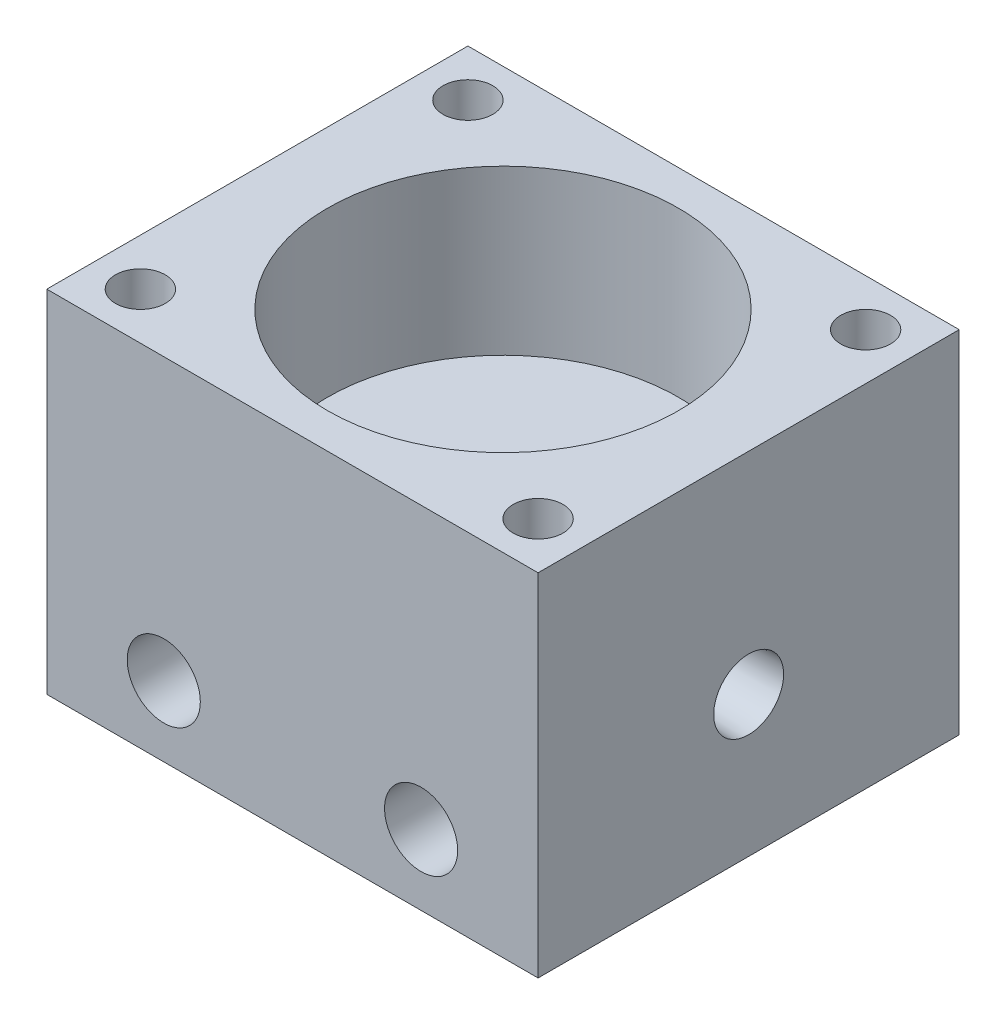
SolidWorks part; units mm, degrees
ref_plane "Front" through (0, 0, 0) normal (0, 0, 1) x (1, 0, 0)
ref_plane "Top" through (0, 0, 0) normal (0, 1, 0) x (1, 0, 0)
ref_plane "Right" through (0, 0, 0) normal (1, 0, 0) x (0, 0, -1)
sketch "Sketch2" plane through (0, 0, 0) normal (0, 1, 0) x (1, 0, 0)
  line L1 (-33.3375, 28.575) -> (33.3375, 28.575)
  line L2 (-33.3375, 28.575) -> (-33.3375, -28.575)
  line L3 (-33.3375, -28.575) -> (33.3375, -28.575)
  line L4 (33.3375, 28.575) -> (33.3375, -28.575)
  line L5 (-33.3375, 28.575) -> (33.3375, -28.575) construction
  line L6 (-33.3375, -28.575) -> (33.3375, 28.575) construction
  circle A2 centre (0, 0) radius 23.8125
  point P0 (0, 0)
extrude "Boss-Extrude1" add sketch "Sketch2" along normal blind 22.225
sketch "Sketch3" plane through (0, 0, 0) normal (0, -1, 0) x (1, 0, 0)
  line L0 (-33.3375, -28.575) -> (-33.3375, 28.575) construction
  line L1 (-33.3375, 28.575) -> (33.3375, 28.575)
  line L2 (-33.3375, 28.575) -> (-33.3375, -28.575)
  line L3 (-33.3375, -28.575) -> (33.3375, -28.575)
  line L4 (33.3375, 28.575) -> (33.3375, -28.575)
  line L5 (-33.3375, 28.575) -> (33.3375, 28.575) construction
  circle A0 centre (0, 0) radius 3.81
extrude "Boss-Extrude2" add sketch "Sketch3" along normal blind 25.4
sketch "Sketch13" plane through (0, 22.225, 0) normal (0, 1, 0) x (1, 0, 0)
  line L1 (-26.9875, 22.225) -> (26.9875, 22.225)
  line L2 (-26.9875, 22.225) -> (-26.9875, -22.225)
  line L3 (-26.9875, -22.225) -> (26.9875, -22.225)
  line L4 (26.9875, 22.225) -> (26.9875, -22.225)
  line L5 (33.3375, 28.575) -> (-33.3375, 28.575) construction
  line L6 (-33.3375, 28.575) -> (-33.3375, -28.575) construction
  point P124 (0, 22.225)
  point P126 (26.9875, 0)
hole_wizard "1/4 Clearance Hole1" positions "Sketch13" profile "Sketch12" hole size "1/4" standard "ANSI Inch"
sketch "Sketch12" plane through (-26.9875, 22.225, -22.225) normal (1, 0, 0) x (0, 0, 1)
  line L0 (0, 0) -> (0, 47.625)
  line L1 (0, 47.625) -> (3.3782, 47.625)
  line L2 (3.3782, 47.625) -> (3.3782, 0)
  line L5 (3.3782, 0) -> (0, 0)
  line L11 (0, -6.35) -> (0, 107.95) construction
  dimension "Thru Hole Dia." = 6.7564
  dimension "Thru Hole Depth" = 47.625
sketch "Sketch4" plane through (0, -25.4, 0) normal (0, -1, 0) x (1, 0, 0)
  line L0 (0, 7.62) -> (0, -7.62) construction
  line L2 (-2.9308, -7.0338) -> (-20.5154, 0.2931)
  line L3 (-19.05, 7.62) -> (19.05, 7.62)
  line L4 (2.9308, -7.0338) -> (20.5154, 0.2931)
  arc A0 (2.9308, -7.0338) -> (-2.9308, -7.0338) centre (0, 0) cw
  arc A1 (19.05, 7.62) -> (20.5154, 0.2931) centre (19.05, 3.81) cw
  arc A2 (-20.5154, 0.2931) -> (-19.05, 7.62) centre (-19.05, 3.81) cw
  point P0 (0, 0)
  point P2 (0, 0)
  point P8 (0, 7.62)
  point P13 (38.1, 7.62)
  point P16 (-38.1, 7.62)
  dimension "D1" = 3.81
  dimension "D3" = 7.62
  dimension "D2" = 38.1
extrude "Cut-Extrude1" cut sketch "Sketch4" against normal blind 9.525
sketch "Sketch14" plane through (0, 0, 0) normal (0, 0, 1) x (1, 0, 0)
  line L0 (0, 0) -> (0, -15.875) construction
  line L1 (-2.9308, -15.875) -> (2.9308, -15.875) construction
  line L3 (0, -6.6675) -> (-5.1865, -6.6675)
  line L4 (0, -6.6675) -> (0, -9.2075)
  line L5 (0, -9.2075) -> (-5.1865, -9.2075)
  line L6 (-5.1865, -6.6675) -> (-5.1865, -9.2075)
  point P10 (0, -7.9375)
  point P11 (0, -7.9375)
  dimension "D1" = 10.373
  dimension "D2" = 2.54
revolve "Cut-Revolve1" cut sketch "Sketch14" angle 360 about L0
sketch "Sketch10" plane through (0, 0, 28.575) normal (0, 0, -1) x (-1, 0, 0)
  line L0 (0, 0) -> (0, -15.875) construction
  line L2 (17.4625, -15.875) -> (-17.4625, -15.875) construction
  line L4 (33.3375, -25.4) -> (-33.3375, -25.4) construction
  point P0 (-17.4625, -15.875)
  point P2 (17.4625, -15.875)
  point P14 (0, -15.875)
  dimension "D1" = 9.525
  dimension "D2" = 34.925
hole_wizard "1/4 (0.25) Diameter Hole1" positions "Sketch10" profile "Sketch9" hole size "1/4" standard "ANSI Inch"
sketch "Sketch9" plane through (17.4625, -15.875, 28.575) normal (1, 0, 0) x (0, -1, 0)
  line L0 (0, 0) -> (0, 27.9427)
  line L1 (0, 27.9427) -> (3.175, 26.035)
  line L2 (3.175, 26.035) -> (3.175, 0)
  line L5 (3.175, 0) -> (0, 0)
  line L10 (0, 27.9427) -> (-3.175, 26.035) construction
  line L11 (0, -6.35) -> (0, 107.95) construction
  dimension "Hole Dia." = 6.35
  dimension "Hole Depth" = 26.035
  dimension "Drill Angle" = 118
sketch "Sketch7" plane through (0, 0, 28.575) normal (0, 0, -1) x (-1, 0, 0)
  point P0 (-17.4625, -15.875)
  point P2 (17.4625, -15.875)
hole_wizard "7/16-20 Tapped Hole1" positions "Sketch7" profile "Sketch6" tap size "7/16-20" standard "ANSI Inch"
sketch "Sketch6" plane through (17.4625, -15.875, 28.575) normal (1, 0, 0) x (0, -1, 0)
  line L0 (0, 0) -> (0, 12.5056)
  line L1 (0, 12.5056) -> (4.9606, 9.525)
  line L2 (4.9606, 9.525) -> (4.9606, 0)
  line L5 (4.9606, 0) -> (0, 0)
  line L10 (0, 12.5056) -> (-4.9606, 9.525) construction
  line L11 (0, -6.35) -> (0, 107.95) construction
  dimension "Tap Drill Dia." = 9.9212
  dimension "Tap Drill Depth" = 9.525
  dimension "Drill Angle" = 118
sketch "Sketch15" plane through (0, -15.875, 0) normal (0, -1, 0) x (1, 0, 0)
  circle A0 centre (0, 0) radius 6.35
  circle A2 centre (0, 0) radius 3.81 construction
  dimension "D1" = 12.7
extrude "Cut-Extrude2" cut sketch "Sketch15" against normal blind 5.08
sketch "Sketch19" plane through (33.3375, 0, 0) normal (1, 0, 0) x (0, 0, -1)
  line L0 (0, 0) -> (0, -6.35) construction
  point P0 (0, -6.35)
  dimension "D1" = 6.35
hole_wizard "1/4 (0.25) Diameter Hole2" positions "Sketch19" profile "Sketch20" hole size "1/4" standard "ANSI Inch"
sketch "Sketch20" plane through (33.3375, -6.35, 0) normal (0, 1, 0) x (0, 0, -1)
  line L0 (0, 0) -> (0, 20.9577)
  line L1 (0, 20.9577) -> (3.175, 19.05)
  line L2 (3.175, 19.05) -> (3.175, 0)
  line L5 (3.175, 0) -> (0, 0)
  line L10 (0, 20.9577) -> (-3.175, 19.05) construction
  line L11 (0, -6.35) -> (0, 107.95) construction
  dimension "Hole Dia." = 6.35
  dimension "Hole Depth" = 19.05
  dimension "Drill Angle" = 118
sketch "Sketch23" plane through (33.3375, 0, 0) normal (1, 0, 0) x (0, 0, -1)
  circle A0 centre (0, -6.35) radius 3.175 construction
  point P0 (0, -6.35)
hole_wizard "1/8 NPT Tapped Hole1" positions "Sketch23" profile "Sketch22" size "1/8" standard "ANSI Inch"
sketch "Sketch22" plane through (33.3375, -6.35, 0) normal (0, 1, 0) x (0, 0, -1)
  line L0 (0, 0) -> (0, 14.1667)
  line L1 (4.2164, 11.6332) -> (0, 14.1667)
  line L2 (-4.2164, 11.6332) -> (0, 14.1667) construction
  line L3 (4.2164, 11.6332) -> (4.2164, 6.9342)
  line L4 (4.2164, 6.9342) -> (4.5374, 6.9342)
  line L5 (4.5374, 6.9342) -> (4.745, 0)
  line L6 (-4.5374, 6.9342) -> (-4.745, 0) construction
  line L7 (4.745, 0) -> (0, 0)
  line L8 (0, -6.35) -> (0, 107.95) construction
  line L11 (-4.2164, 6.9342) -> (-4.5374, 6.9342) construction
  dimension "Tap Drill Dia." = 8.4328
  dimension "Tap Drill Depth" = 11.6332
  dimension "Thread Dia." = 9.49
  dimension "Thread Angle" = 3.43
  dimension "Thread Depth" = 6.9342
  dimension "Drill Angle" = 118
sketch "Sketch27" plane through (0, 0, 0) normal (0, 1, 0) x (1, 0, 0)
  line L0 (33.3375, 0) -> (14.2875, 0) construction
  line L1 (33.3375, -4.745) -> (33.3375, 4.745) construction
  point P0 (14.2875, 0)
  dimension "D1" = 19.05
hole_wizard "1/4 (0.25) Diameter Hole3" positions "Sketch27" profile "Sketch26" hole size "1/4" standard "ANSI Inch"
sketch "Sketch26" plane through (14.2875, 0, 0) normal (1, 0, 0) x (0, 0, 1)
  line L0 (0, 0) -> (0, 11.4327)
  line L1 (0, 11.4327) -> (3.175, 9.525)
  line L2 (3.175, 9.525) -> (3.175, 0)
  line L5 (3.175, 0) -> (0, 0)
  line L10 (0, 11.4327) -> (-3.175, 9.525) construction
  line L11 (0, -6.35) -> (0, 107.95) construction
  dimension "Hole Dia." = 6.35
  dimension "Hole Depth" = 9.525
  dimension "Drill Angle" = 118
equation "\"dp\"=1.875"
equation "\"dr\"= .3"
equation "\"s\"= .375"
equation "\"D1@Sketch2\"=\"dp\""
equation "\"D2@Sketch2\"=\"dp\"+.75"
equation "\"D1@Boss-Extrude1\"=\"s\"+.5"
equation "\"D1@Sketch3\"=\"dr\""
equation "\"D3@Sketch2\"=\"dp\"+.375"
equation "\"D2@Sketch13\"=\"D1@Sketch13\""
equation "\"D1@Cut-Extrude1\"=\"s\""
